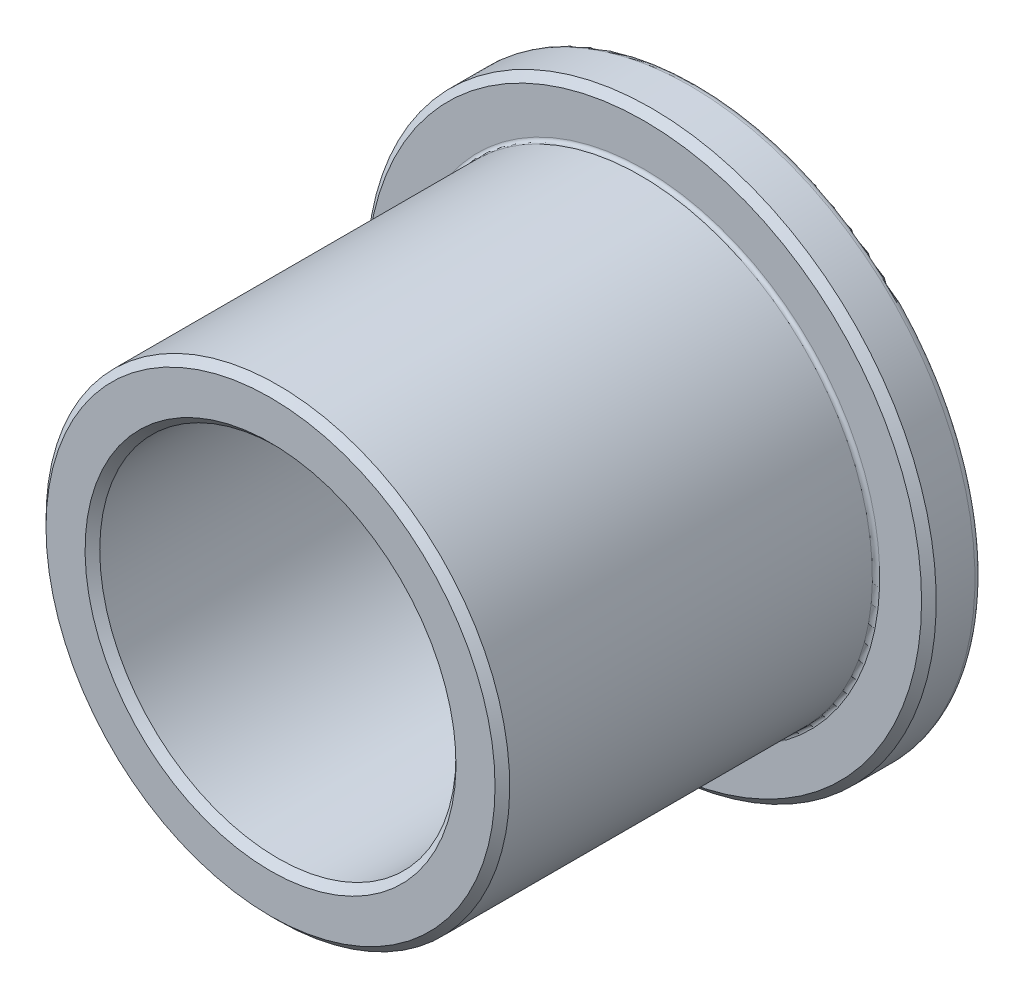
SolidWorks part; units mm, degrees
ref_plane "Front Plane" through (0, 0, 0) normal (0, 0, 1) x (1, 0, 0)
ref_plane "Top Plane" through (0, 0, 0) normal (0, 1, 0) x (1, 0, 0)
ref_plane "Right Plane" through (0, 0, 0) normal (1, 0, 0) x (0, 0, -1)
sketch "Sketch1" plane through (0, 0, 0) normal (0, 0, 1) x (1, 0, 0)
  circle A0 centre (0, 0) radius 5.005
  circle A1 centre (0, 0) radius 6.515
  circle A2 centre (0, 0) radius 8
  point P5 (0, 6.515)
  point P6 (0, 5.005)
  point P7 (0, 8)
  dimension "ID" = 10.01
  dimension "OD" = 13.03
  dimension "Flange OD" = 16
sketch "Sketch2" plane through (0, 0, 0) normal (1, 0, 0) x (0, 0, -1)
  line L0 (6, 0) -> (-6, 0)
  line L1 (6, 0) -> (6, 8)
  line L2 (6, 8) -> (4.5, 8)
  line L3 (4.5, 8) -> (4.5, 6.515)
  line L4 (4.5, 6.515) -> (-6, 6.515)
  line L5 (-6, 6.515) -> (-6, 5.005)
  line L6 (-6, 5.005) -> (6, 5.005)
  point P4 (0, 0)
sketch "Sketch3" plane through (0, 0, 0) normal (1, 0, 0) x (0, 0, -1)
  line L0 (6, 8) -> (4.5, 8) construction
  line L1 (4.5, 8) -> (4.5, 6.515) construction
  line L2 (4.5, 6.515) -> (-6, 6.515) construction
  line L3 (-6, 5.005) -> (6, 5.005) construction
  line L4 (-6, 6.515) -> (-6, 5.005) construction
  line L5 (6, 8) -> (4.5, 8)
  line L6 (4.5, 8) -> (4.5, 6.515)
  line L7 (4.5, 6.515) -> (-6, 6.515)
  line L8 (-6, 5.005) -> (6, 5.005)
  line L9 (-6, 6.515) -> (-6, 5.005)
  line L10 (6, 8) -> (6, 5.005)
revolve "Revolve1" add sketch "Sketch3" angle 360 about L0
chamfer "Chamfer1" distance 0.2063 angle 45 3 edges at (0, 8, -4.5) (0, 6.515, 6) (0, 5.005, 6)
fillet "Fillet1" radius 0.2062 1 edges at (0, 8, -6)
fillet "Fillet2" radius 0.1031 1 edges at (0, 6.515, -4.5)
equation "\"D1@Chamfer1\"=\"Flange Thickness@Sketch2\"*.1375"
equation "\"D1@Fillet1\"=\"D1@Chamfer1\""
equation "\"D1@Fillet2\"=\"D1@Fillet1\"*.5"
